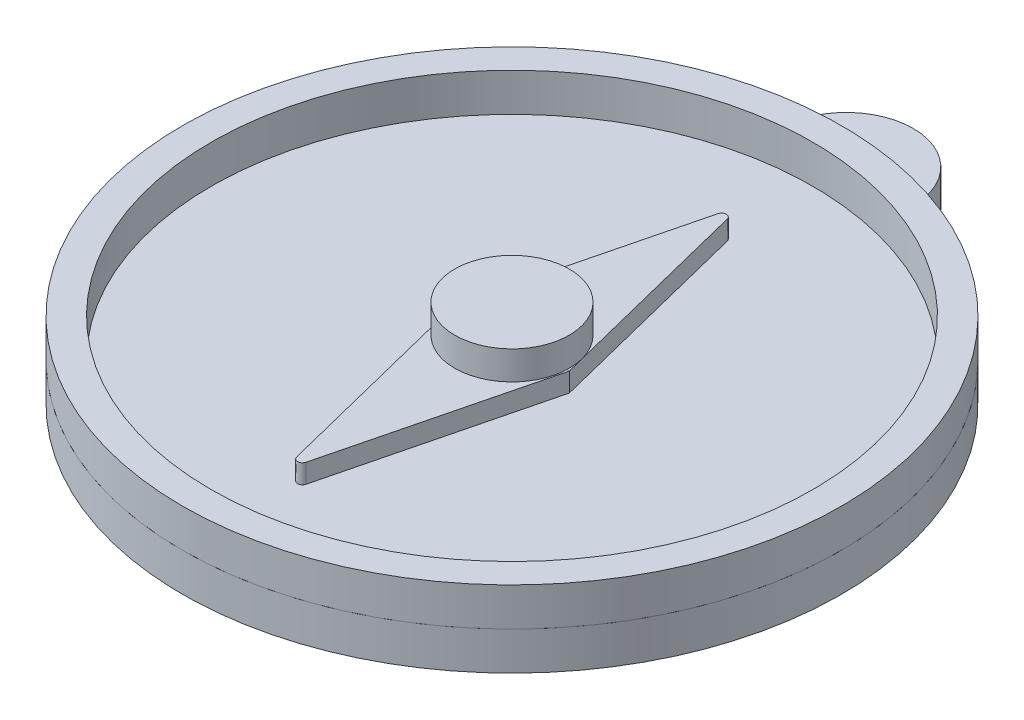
SolidWorks part; units mm, degrees
other "Compass Arrow"
other "Compass Rim"
other "Compass Base"
ref_plane "Front Plane" through (0, 0, 0) normal (0, 0, 1) x (1, 0, 0)
ref_plane "Top Plane" through (0, 0, 0) normal (0, 1, 0) x (1, 0, 0)
ref_plane "Right Plane" through (0, 0, 0) normal (1, 0, 0) x (0, 0, -1)
sketch "Sketch1" plane through (0, 0, 0) normal (0, 1, 0) x (1, 0, 0)
  arc A0 (-6.897, 33.8036) -> (6.897, 33.8036) centre (0, 0) ccw
  arc A1 (6.897, 33.8036) -> (-6.897, 33.8036) centre (0, 35) ccw
  point P1 (0, 0)
  dimension "D1" = 69
  dimension "D2" = 76.5
  dimension "D3" = 14
extrude "Boss-Extrude1" add sketch "Sketch1" along normal blind 4
sketch "Sketch2" plane through (0, 4, 0) normal (0, 1, 0) x (1, 0, 0)
  circle A0 centre (0, 0) radius 34.5
  circle A1 centre (0, 0) radius 31.5
  dimension "D1" = 3
extrude "Boss-Extrude2" add sketch "Sketch2" along normal blind 4 separate body
sketch "Sketch3" plane through (0, 4, 0) normal (0, 1, 0) x (1, 0, 0)
  line L1 (0, 24) -> (-6, 0)
  line L2 (-6, 0) -> (0, -24)
  line L3 (0, -24) -> (6, 0)
  line L4 (6, 0) -> (0, 24)
  circle A0 centre (0, 0) radius 2
  dimension "D3" = 4
  dimension "D1" = 48
  dimension "D2" = 12
extrude "Boss-Extrude3" add sketch "Sketch3" along normal blind 2 separate body
fillet "Fillet1" radius 0.5 2 edges at (0, 5, -24) (0, 5, 24)
sketch "Sketch4" plane through (0, 4, 0) normal (0, 1, 0) x (1, 0, 0)
  circle A0 centre (0, 0) radius 1.625
  dimension "D1" = 3.25
extrude "Boss-Extrude4" add sketch "Sketch4" along normal blind 2.25
sketch "Sketch5" plane through (0, 6.25, 0) normal (0, 1, 0) x (1, 0, 0)
  circle A0 centre (0, 0) radius 6
  dimension "D1" = 12
extrude "Boss-Extrude5" add sketch "Sketch5" along normal blind 3
sketch "Sketch6" plane through (0, 6, 0) normal (0, 1, 0) x (1, 0, 0)
  line L0 (-6, 0) -> (6, 0)
  circle A0 centre (0, 0) radius 6 construction
other "Save Bodies1"
